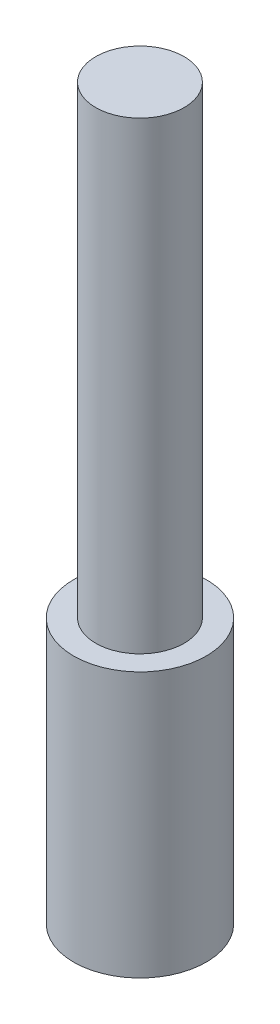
SolidWorks part; units mm, degrees
ref_plane "Front Plane" through (0, 0, 0) normal (0, 0, 1) x (1, 0, 0)
ref_plane "Top Plane" through (0, 0, 0) normal (0, 1, 0) x (1, 0, 0)
ref_plane "Right Plane" through (0, 0, 0) normal (1, 0, 0) x (0, 0, -1)
sketch "Sketch1" plane through (0, 0, 0) normal (0, 1, 0) x (1, 0, 0)
  circle A0 centre (1.5, 0) radius 1.5
  dimension "D1" = 3
extrude "Boss-Extrude1" add sketch "Sketch1" along normal blind 6
sketch "Sketch2" plane through (0, 6, 0) normal (0, 1, 0) x (1, 0, 0)
  circle A0 centre (1.5, 0) radius 1
  dimension "D1" = 2
extrude "Boss-Extrude2" add sketch "Sketch2" along normal blind 10.5
ref_plane "Plane1" through (0.5, 0, 0) normal (-1, 0, 0) x (0, 0, 1)
sketch "Sketch3" plane through (0.5, 0, 0) normal (-1, 0, 0) x (0, 0, 1)
  line L0 (1, 16.5) -> (-1, 16.5) construction
  line L1 (-0.5, 6) -> (0.5, 6)
  line L2 (-0.5, 6) -> (-0.5, 7.5)
  line L3 (-0.5, 7.5) -> (0.5, 7.5)
  line L4 (0.5, 6) -> (0.5, 7.5)
  line L5 (-0.5, 6) -> (0.5, 7.5) construction
  line L6 (-0.5, 7.5) -> (0.5, 6) construction
  line L7 (-0.5, 12) -> (0.5, 12)
  line L8 (-0.5, 12) -> (-0.5, 13.5)
  line L9 (-0.5, 13.5) -> (0.5, 13.5)
  line L10 (0.5, 12) -> (0.5, 13.5)
  line L11 (-0.5, 12) -> (0.5, 13.5) construction
  line L12 (-0.5, 13.5) -> (0.5, 12) construction
  line L13 (-1.5, 0) -> (1.5, 0) construction
  point P0 (0, 6.75)
  point P5 (0, 12.75)
  dimension "D1" = 1
  dimension "D2" = 1.5
  dimension "D3" = 3
  dimension "D4" = 6
extrude "Cut-Extrude1" cut sketch "Sketch3" against normal blind 1
